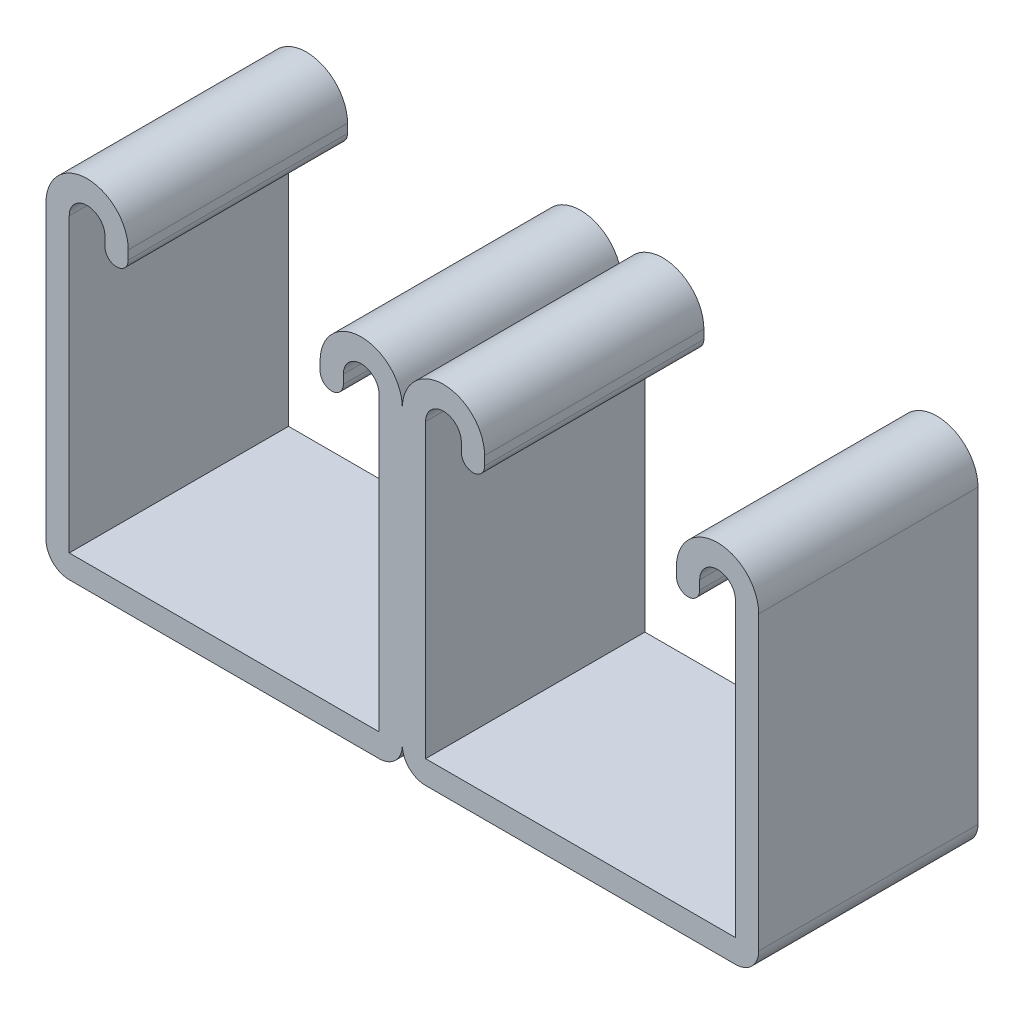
SolidWorks part; units mm, degrees
ref_plane "Plane1" through (0, 0, 0) normal (0, 0, 1) x (1, 0, 0)
ref_plane "Plane2" through (0, 0, 0) normal (0, 1, 0) x (1, 0, 0)
ref_plane "Plane3" through (0, 0, 0) normal (1, 0, 0) x (0, 0, -1)
sketch "Sketch1" plane through (0, 0, 0) normal (0, 0, 1) x (1, 0, 0)
  line L0 (-41.275, 18.4785) -> (-41.275, -15.3416)
  line L1 (-38.5826, -18.034) -> (-2.6924, -18.034)
  line L2 (0, -15.3416) -> (0, 18.4785)
  line L3 (-9.525, 18.4785) -> (-9.525, 17.4434)
  line L4 (-31.75, 18.4785) -> (-31.75, 17.4434)
  line L5 (-34.4424, 18.4785) -> (-34.4424, 17.4434)
  line L6 (-38.5826, 18.4785) -> (-38.5826, -15.3416)
  line L7 (-38.5826, -15.3416) -> (-2.6924, -15.3416)
  line L8 (-2.6924, -15.3416) -> (-2.6924, 18.4785)
  line L9 (-6.8326, 18.4785) -> (-6.8326, 17.4434)
  line L10 (-44.483, 23.241) -> (25.4, 23.241) construction
  line L11 (-36.5125, 16.0972) -> (12.8524, 16.0972) construction
  arc A0 (0, 18.4785) -> (-9.525, 18.4785) centre (-4.7625, 18.4785) ccw
  arc A1 (-41.275, 18.4785) -> (-31.75, 18.4785) centre (-36.5125, 18.4785) cw
  arc A2 (-38.5826, -18.034) -> (-41.275, -15.3416) centre (-38.5826, -15.3416) cw
  arc A3 (-2.6924, -18.034) -> (0, -15.3416) centre (-2.6924, -15.3416) ccw
  arc A4 (-38.5826, 18.4785) -> (-34.4424, 18.4785) centre (-36.5125, 18.4785) cw
  arc A5 (-2.6924, 18.4785) -> (-6.8326, 18.4785) centre (-4.7625, 18.4785) ccw
  arc A6 (-9.525, 17.4434) -> (-6.8326, 17.4434) centre (-8.1788, 17.4434) ccw
  arc A7 (-31.75, 17.4434) -> (-34.4424, 17.4434) centre (-33.0962, 17.4434) cw
  dimension "D1" = 2.6924
  dimension "Width" = 41.275
  dimension "D5" = 18.034
  dimension "D6" = 9.525
  dimension "D7" = 22.225
  dimension "D8" = 23.241
  dimension "D9" = 7.1437
  dimension "gauge" = 2.6924
extrude "Base-Extrude" add sketch "Sketch1" along normal mid plane 25.4
pattern_linear "LPattern1" count 2 spacing 41.275 along (1, 0, 0) of "Base-Extrude"
equation "\"D7@Sketch1\" = \"Width@Sketch1\" - 2 * \"D6@Sketch1\""
equation "\"D1@Sketch1\" = \"gauge@Sketch1\""
